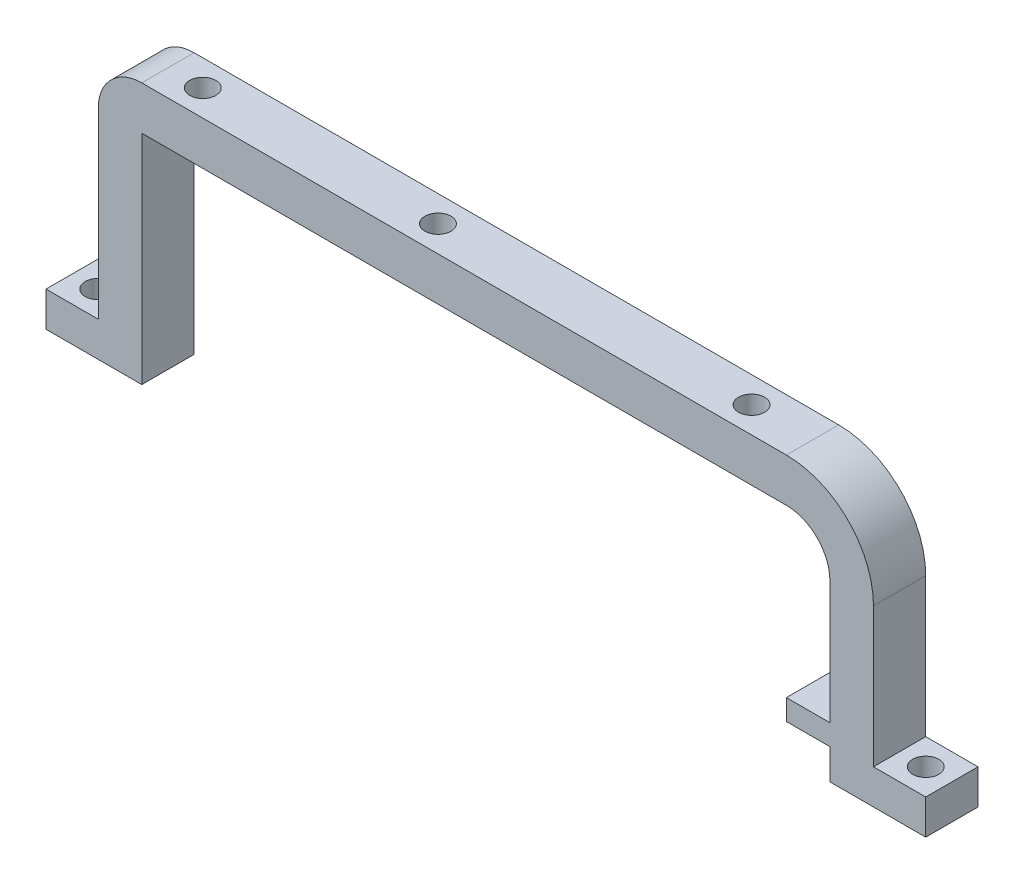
SolidWorks part; units mm, degrees
ref_plane "Plano frontal" through (0, 0, 0) normal (0, 0, 1) x (1, 0, 0)
ref_plane "Plano superior" through (0, 0, 0) normal (0, 1, 0) x (1, 0, 0)
ref_plane "Plano direito" through (0, 0, 0) normal (1, 0, 0) x (0, 0, -1)
sketch "Esboço2" plane through (0, 0, 0) normal (0, 0, 1) x (1, 0, 0)
  line L0 (40.8036, -5.8834) -> (48.8036, -5.8834) construction
  line L1 (40.8036, 0) -> (40.8036, 14.1166)
  line L2 (-38.1964, 24.1166) -> (35.8036, 24.1166) construction
  line L3 (-46.1964, -5.8834) -> (-38.1964, -5.8834) construction
  line L4 (48.8036, -1.8834) -> (48.8036, -5.8834) construction
  line L5 (-43.1964, -5.8834) -> (-38.1964, -5.8834)
  line L6 (-43.1964, -1.8834) -> (-43.1964, 19.1166)
  line L7 (35.8036, -2.3834) -> (40.8036, -2.3834)
  line L8 (-38.1964, -5.8834) -> (-38.1964, 19.1166)
  line L9 (-43.1964, -1.8834) -> (-49.1964, -1.8834)
  line L10 (35.8036, -2.3834) -> (35.8036, 0)
  line L11 (-43.1964, -5.8834) -> (-49.1964, -5.8834)
  line L12 (-49.1964, -1.8834) -> (-49.1964, -5.8834)
  line L13 (40.8036, -5.8834) -> (45.8036, -5.8834)
  line L14 (40.8036, -5.8834) -> (40.8036, -2.3834)
  line L15 (35.8036, 0) -> (40.8036, 0)
  line L16 (45.8036, -1.8834) -> (45.8036, 14.1166)
  line L17 (51.8036, -5.8834) -> (45.8036, -5.8834)
  line L18 (51.8036, -5.8834) -> (51.8036, -1.8834)
  line L19 (51.8036, -1.8834) -> (45.8036, -1.8834)
  line L21 (-38.1964, 19.1166) -> (35.8036, 19.1166)
  line L23 (-38.1964, 24.1166) -> (35.8036, 24.1166)
  arc A0 (-38.1964, 24.1166) -> (-43.1964, 19.1166) centre (-38.1964, 19.1166) ccw
  arc A1 (35.8036, 24.1166) -> (45.8036, 14.1166) centre (35.8036, 14.1166) cw
  arc A2 (35.8036, 19.1166) -> (40.8036, 14.1166) centre (35.8036, 14.1166) cw
  point P0 (40.8036, -2.3834)
  point P3 (40.8036, 0)
  point P4 (-49.1964, -5.8834)
  point P5 (-46.1964, -5.8834)
  point P6 (-43.1964, -5.8834)
  point P7 (-38.1964, -5.8834)
  point P10 (35.8036, -2.3834)
  point P12 (-43.1964, -1.8834)
  point P16 (51.8036, -5.8834)
  point P17 (45.8036, -5.8834)
  point P18 (40.8036, -5.8834)
  point P19 (48.8036, -1.8834)
  point P27 (-38.1964, 19.1166)
  dimension "D11" = 5
  dimension "D12" = 10
  dimension "D13" = 5
  dimension "D2" = 3.5
  dimension "D3" = 3
  dimension "D4" = 3
  dimension "D5" = 8
  dimension "D6" = 4
  dimension "D7" = 3
  dimension "D8" = 3
  dimension "D9" = 5
  dimension "D10" = 4
  dimension "D14" = 5
extrude "Ressalto-extrusão1" add sketch "Esboço2" along normal blind 6
sketch "Esboço4" plane through (0, -1.8834, 0) normal (0, 1, 0) x (1, 0, 0)
  line L0 (51.8036, 0) -> (45.8036, 0) construction
  circle A0 centre (48.8036, -3) radius 1.5
  point P0 (48.8036, 0)
  point P1 (48.8036, -3)
  dimension "D1" = 3
extrude "Corte-extrusão1" cut sketch "Esboço4" against normal blind 6
sketch "Esboço5" plane through (0, -1.8834, 0) normal (0, 1, 0) x (1, 0, 0)
  line L0 (-49.1964, -6) -> (-49.1964, 0) construction
  line L1 (-43.1964, -6) -> (-49.1964, -6) construction
  circle A0 centre (-46.1964, -3) radius 1.5
  point P0 (-49.1964, -3)
  point P1 (-46.1964, -6)
  point P4 (-46.1964, -3)
  dimension "D1" = 3
extrude "Corte-extrusão2" cut sketch "Esboço5" against normal blind 6
sketch "Esboço11" plane through (0, 24.1166, 0) normal (0, 1, 0) x (1, 0, 0)
  line L0 (35.8036, -6) -> (35.8036, 0) construction
  circle A0 centre (28.8036, -3) radius 1.5
  point P0 (35.8036, -3)
  point P1 (48.8036, -3)
  point P4 (28.8036, -3)
  dimension "D2" = 3
  dimension "D1" = 20
extrude "Corte-extrusão6" cut sketch "Esboço11" against normal through all contours A0
sketch "Esboço12" plane through (0, 24.1166, 0) normal (0, 1, 0) x (1, 0, 0)
  line L0 (-38.1964, -6) -> (-38.1964, 0) construction
  circle A0 centre (-34.1964, -3) radius 1.5
  point P0 (-38.1964, -3)
  point P1 (-34.1964, -3)
  dimension "D2" = 3
  dimension "D1" = 4
extrude "Corte-extrusão7" cut sketch "Esboço12" against normal through all
sketch "Esboço14" plane through (0, 24.1166, 0) normal (0, 1, 0) x (1, 0, 0)
  circle A0 centre (-7.1964, -3) radius 1.5
  point P0 (-34.1964, -3)
  point P1 (-7.1964, -3)
  dimension "D2" = 3
  dimension "D1" = 27
extrude "Corte-extrusão8" cut sketch "Esboço14" against normal through all
